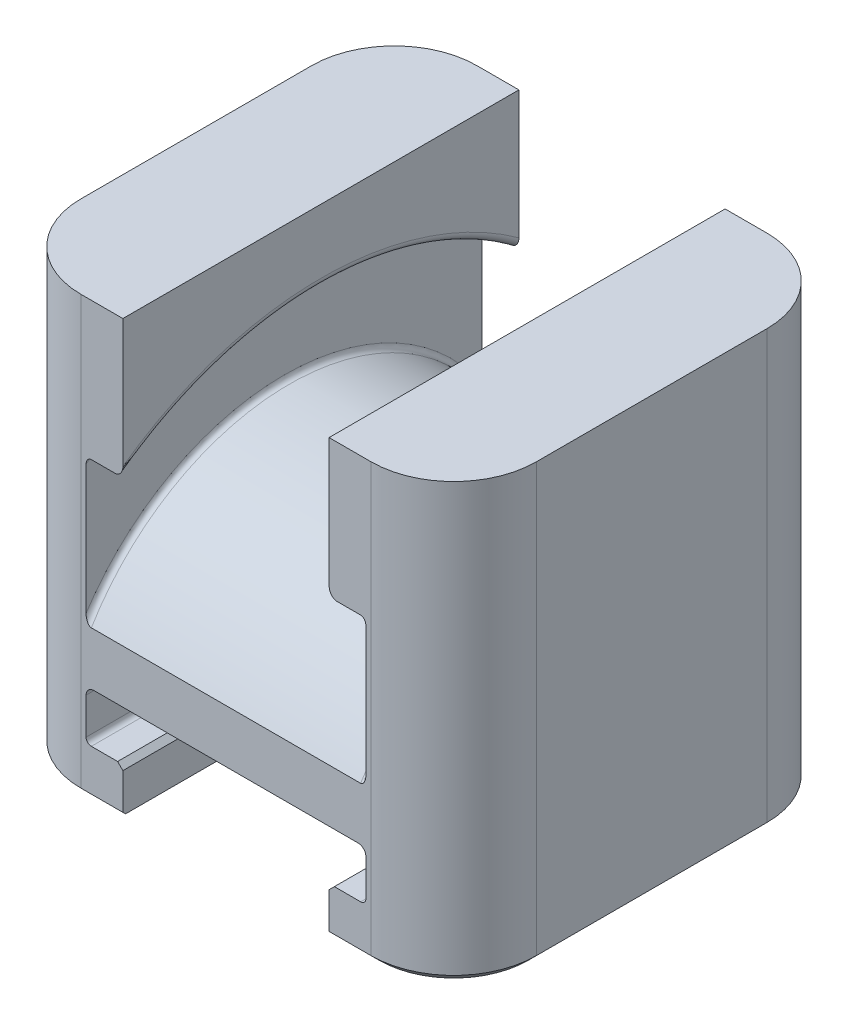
SolidWorks part; units mm, degrees
ref_plane "Front Plane" through (0, 0, 0) normal (0, 0, 1) x (1, 0, 0)
ref_plane "Top Plane" through (0, 0, 0) normal (0, 1, 0) x (1, 0, 0)
ref_plane "Right Plane" through (0, 0, 0) normal (1, 0, 0) x (0, 0, -1)
sketch "Sketch1" plane through (0, 0, 0) normal (1, 0, 0) x (0, 0, -1)
  line L0 (0, -3.175) -> (0, 0) construction
  line L1 (-19.05, 38.735) -> (19.05, 38.735)
  line L2 (-19.05, 38.735) -> (-19.05, -3.175)
  line L3 (-19.05, -3.175) -> (19.05, -3.175)
  line L4 (19.05, 38.735) -> (19.05, -3.175)
  dimension "D1" = 38.1
  dimension "D2" = 41.91
  dimension "D3" = 3.175
extrude "Extrude1" add sketch "Sketch1" along normal mid plane 43.815
sketch "Sketch2" plane through (0, 0, 0) normal (0, 0, -1) x (-1, 0, 0)
  line L0 (18.4383, 0) -> (-15.4771, 0) construction
  line L1 (13.462, 22.225) -> (13.462, 31.8008)
  line L2 (13.462, 31.8008) -> (9.9187, 31.8008)
  line L3 (-13.462, 31.8008) -> (-13.462, 22.225)
  line L4 (-13.462, 22.225) -> (13.462, 22.225)
  line L5 (0, 0) -> (0, 22.225) construction
  line L6 (9.9187, 31.8008) -> (9.9187, 43.2308)
  line L7 (9.9187, 43.2308) -> (-9.9187, 43.2308)
  line L8 (-9.9187, 43.2308) -> (-9.9187, 31.8008)
  line L9 (-9.9187, 31.8008) -> (-13.462, 31.8008)
  line L10 (0, 22.225) -> (0, 43.2308) construction
  dimension "D1" = 22.225
  dimension "D2" = 31.8008
  dimension "D4" = 26.924
  dimension "D6" = 19.8374
  dimension "D7" = 11.43
revolve "Cut-Revolve1" cut sketch "Sketch2" angle 180 mid plane about L0
sketch "Sketch3" plane through (0, 0, 0) normal (0, 0, 1) x (1, 0, 0)
  line L0 (-13.462, 6.35) -> (13.462, 6.35)
  line L1 (13.462, 6.35) -> (13.462, 1.5748)
  line L2 (13.462, 1.5748) -> (9.9187, 1.5748)
  line L3 (9.9187, 1.5748) -> (9.9187, -3.175)
  line L4 (9.9187, -3.175) -> (-9.9187, -3.175)
  line L5 (-9.9187, -3.175) -> (-9.9187, 1.5748)
  line L6 (-9.9187, 1.5748) -> (-13.462, 1.5748)
  line L7 (-13.462, 1.5748) -> (-13.462, 6.35)
  line L14 (21.9075, -3.175) -> (-21.9075, -3.175) construction
  line L15 (13.462, 11.4476) -> (13.462, 25.4635) construction
  line L16 (-13.462, 11.4476) -> (-13.462, 22.225) construction
  line L17 (9.9187, 25.4635) -> (9.9187, 38.735) construction
  line L18 (-9.9187, 38.735) -> (-9.9187, 25.4635) construction
  dimension "D1" = 9.525
  dimension "D2" = 4.7498
extrude "Cut-Extrude1" cut sketch "Sketch3" against normal through all both and the other way through all
fillet "Fillet1" radius 7.9502 4 edges at (21.9075, 17.78, -19.05) (21.9075, 17.78, 19.05) (-21.9075, 17.78, 19.05) (-21.9075, 17.78, -19.05)
fillet "Fillet2" radius 0.508 2 edges at (13.462, 1.5748, 0) (-13.462, 1.5748, 0)
fillet "Fillet3" radius 0.508 4 edges at (13.462, 31.8008, 0) (13.462, 22.225, 0) (-13.462, 22.225, 0) (-13.462, 31.8008, 0)
fillet "Fillet4" radius 0.762 4 edges at (-9.9187, 31.8008, 0) (9.9187, 31.8008, 0) (-13.462, 6.35, 0) (13.462, 6.35, 0)
chamfer "Chamfer1" distance 0.508 angle 45 2 edges at (9.9187, 1.5748, 0) (-9.9187, 1.5748, 0)
chamfer "Chamfer2" distance 0.508 angle 45 2 edges at (-9.9187, -3.175, 0) (9.9187, -3.175, 0)
chamfer "Chamfer3" distance 0.762 angle 45 10 edges at (-19.5789, -3.175, 16.7214) (-12.192, -3.175, 19.05) (12.192, -3.175, 19.05) (-21.9075, -3.175, 0) (-12.192, -3.175, -19.05) (12.192, -3.175, -19.05) (-19.5789, -3.175, -16.7214) (19.5789, -3.175, 16.7214) (21.9075, -3.175, 0) (19.5789, -3.175, -16.7214)
